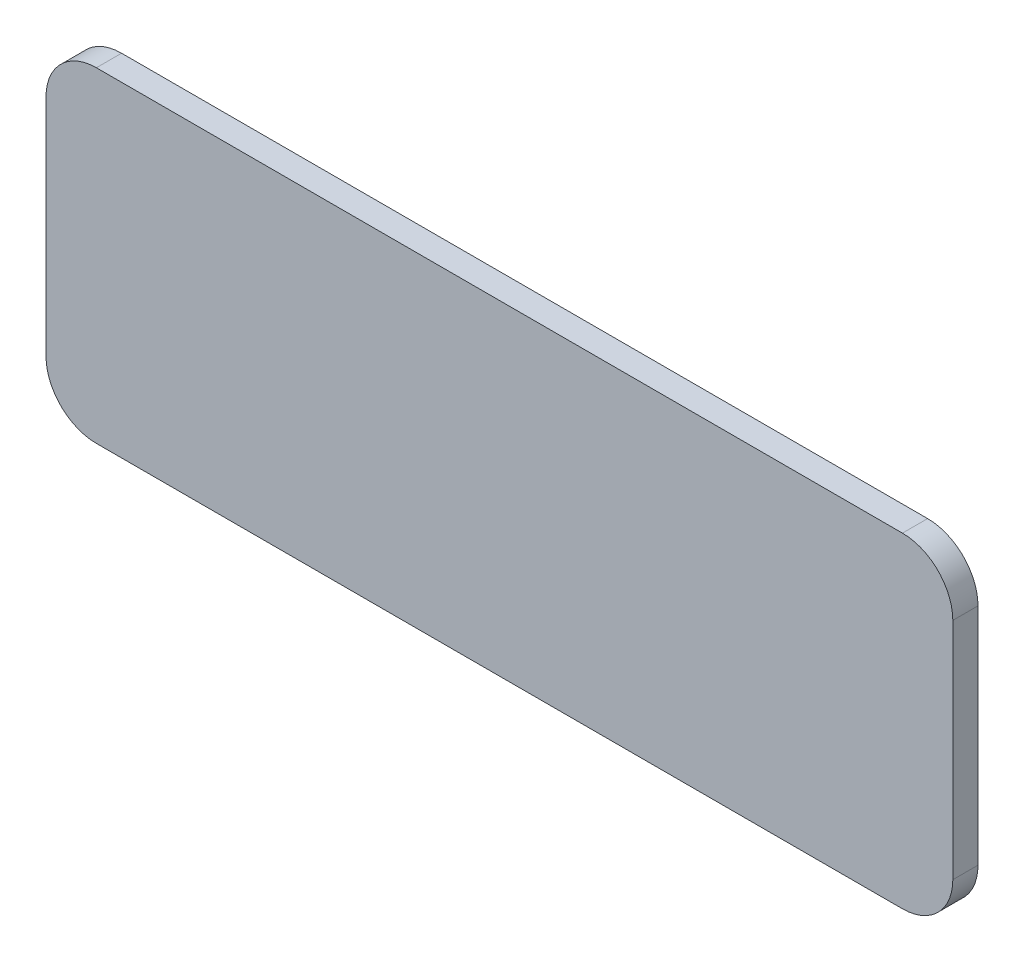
SolidWorks part; units mm, degrees
ref_plane "Front Plane" through (0, 0, 0) normal (0, 0, 1) x (1, 0, 0)
ref_plane "Top Plane" through (0, 0, 0) normal (0, 1, 0) x (1, 0, 0)
ref_plane "Right Plane" through (0, 0, 0) normal (1, 0, 0) x (0, 0, -1)
sketch "Skizze1" plane through (0, 0, 0) normal (0, 0, 1) x (1, 0, 0)
  line L0 (15.5, -5.55) -> (15.5, -1.95) construction
  line L1 (15.5, -0.092) -> (31.5, -0.092)
  line L2 (14.5, -1.092) -> (14.5, -5.55)
  line L3 (15.5, -6.55) -> (31.5, -6.55)
  line L4 (32.5, -1.092) -> (32.5, -5.55)
  line L9 (31.5, -1.95) -> (31.5, -5.55) construction
  arc A0 (14.5, -1.092) -> (15.5, -0.092) centre (15.5, -1.092) cw
  arc A1 (15.5, -6.55) -> (14.5, -5.55) centre (15.5, -5.55) cw
  arc A2 (31.5, -6.55) -> (32.5, -5.55) centre (31.5, -5.55) ccw
  arc A3 (31.5, -0.092) -> (32.5, -1.092) centre (31.5, -1.092) cw
  dimension "D1" = 1
  dimension "D5" = 1
  dimension "D7" = 1
extrude "Linear austragen1" add sketch "Skizze1" against normal blind 0.5
